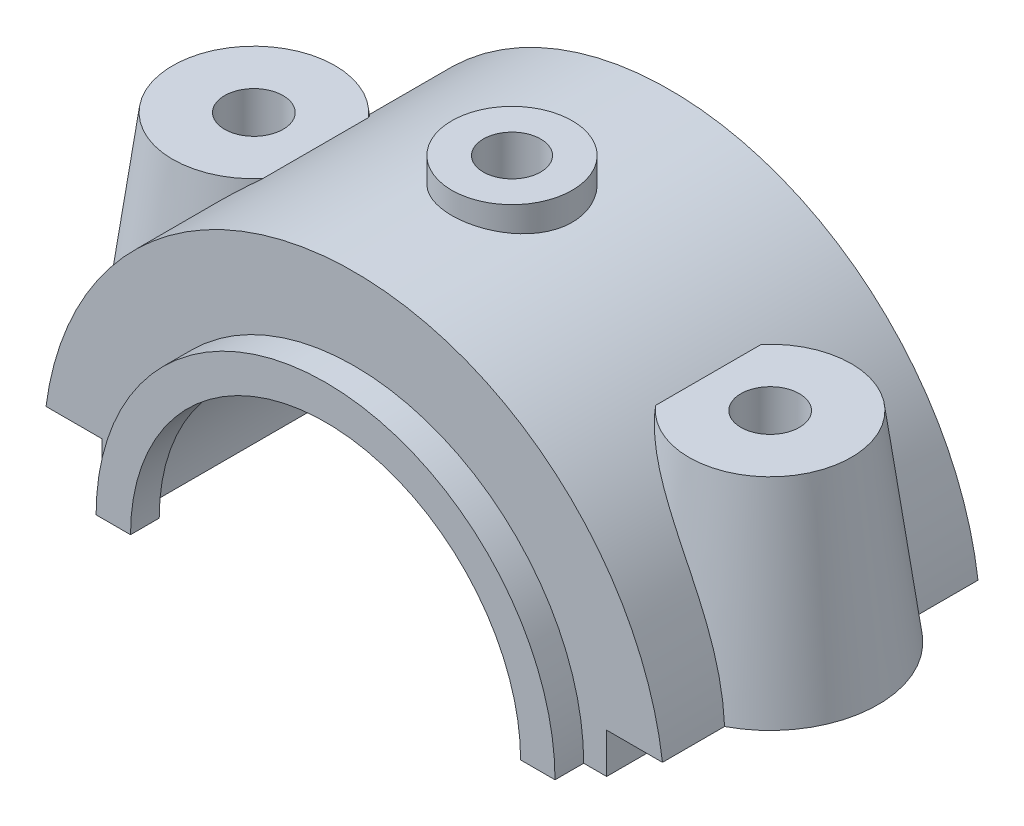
SolidWorks part; units mm, degrees
ref_plane "前视基准面" through (0, 0, 0) normal (0, 0, 1) x (1, 0, 0)
ref_plane "上视基准面" through (0, 0, 0) normal (0, 1, 0) x (1, 0, 0)
ref_plane "右视基准面" through (0, 0, 0) normal (1, 0, 0) x (0, 0, -1)
sketch "草图1" plane through (0, 0, 0) normal (0, 0, 1) x (1, 0, 0)
  line L0 (0, 0) -> (0, 153.2464) construction
  line L1 (-53.7333, 77) -> (-44, 77)
  line L2 (-44, 77) -> (-44, 70)
  line L3 (-44, 70) -> (-40, 70)
  line L4 (-55.1879, 66.0906) -> (-49.1983, 111.0131) construction
  line L5 (-54, 75) -> (-60, 30) construction
  line L6 (-44, 75) -> (-54, 75) construction
  line L7 (0, 124.1874) -> (0, 110)
  arc A0 (-40, 70) -> (0, 110) centre (0, 70) cw
  arc A1 (-53.7333, 77) -> (0, 124.1874) centre (0, 70) cw
  dimension "D1" = 2
extrude "拉伸1" add sketch "草图1" along normal mid plane 55
sketch "草图2" plane through (0, 0, 0) normal (0, 0, 1) x (1, 0, 0)
  line L0 (-40, 70) -> (-34, 70)
  line L1 (0, 110) -> (0, 104)
  arc A0 (0, 110) -> (-40, 70) centre (0, 70) ccw construction
  arc A1 (0, 110) -> (-40, 70) centre (0, 70) ccw
  arc A2 (-34, 70) -> (0, 104) centre (0, 70) cw
extrude "拉伸2" add sketch "草图2" along normal up to surface (32.5 mm away) and the other way up to surface (32.5 mm away)
sketch "草图4" plane through (0, 0, 0) normal (0, 0, 1) x (1, 0, 0)
  line L0 (-45, 4) -> (-45, 133.4851) construction
  line L1 (-60, 4) -> (-30, 4) construction
  line L2 (-45, 77) -> (-63.8218, 77)
  line L3 (-63.8218, 77) -> (-59.1552, 112)
  line L4 (-59.1552, 112) -> (-45, 112)
  line L5 (-45, 112) -> (-45, 77)
  line L6 (-53.7333, 77) -> (-44, 77) construction
  line L7 (-64.0885, 75) -> (-69.5552, 34) construction
  line L8 (-120, 0) -> (-60, 0) construction
  dimension "D1" = 112
revolve "旋转2" add sketch "草图4" angle 360 about L0
hole_wizard "M12 螺纹孔1" positions "草图6" profile "草图5" tap size "M12" standard "ISO"
sketch "草图6" plane through (0, 112, 0) normal (0, 1, 0) x (-1, 0, 0)
  point P1 (45, 0)
sketch "草图5" plane through (-45, 112, 0) normal (1, 0, 0) x (0, 0, 1)
  line L0 (0, 0) -> (0, 42)
  line L1 (0, 42) -> (5.1, 42)
  line L2 (5.1, 42) -> (5.1, 0)
  line L5 (5.1, 0) -> (0, 0)
  line L11 (0, -6.35) -> (0, 107.95) construction
  dimension "籵謂蹟恇謂郰芛眻噤" = 10.2
  dimension "籵謂蹟恇謂郰芛旮僅" = 42
sketch "草图7" plane through (0, 0, 0) normal (0, 0, 1) x (1, 0, 0)
  line L0 (0, 70) -> (-37, 70)
  line L1 (0, 107) -> (0, 70)
  arc A0 (0, 107) -> (-37, 70) centre (0, 70) ccw
  dimension "D1" = 37
extrude "切除-拉伸2" cut sketch "草图7" against normal up to surface and the other way up to surface
mirror "镜向1" about plane through (0, 124.1874, 27.5) normal (-1, 0, 0)
ref_plane "基准面1" through (0, 128, 0) normal (0, 1, 0) x (-1, 0, 0)
sketch "草图8" plane through (0, 128, 0) normal (0, 1, 0) x (-1, 0, 0)
  circle A0 centre (0, 0) radius 10.5
  dimension "D1" = 21
extrude "拉伸3" add sketch "草图8" against normal up to next
sketch "草图9" plane through (0, 0, 0) normal (0, 0, 1) x (1, 0, 0)
  line L0 (0, 110) -> (0, 115.2362) construction
  line L1 (-3, 106) -> (0, 106)
  line L2 (-3, 99.8496) -> (-3, 96) construction
  line L3 (0, 114) -> (-3, 114)
  line L4 (-3, 114) -> (-3, 106)
  line L5 (0, 106) -> (0, 114)
  line L7 (3, 96) -> (-3, 96) construction
  arc A0 (40, 70) -> (-40, 70) centre (0, 70) ccw construction
  dimension "D1" = 10
  dimension "D2" = 18
revolve "切除-旋转2" cut sketch "草图9" angle 360 about L0
sketch "草图10" plane through (0, 128, 0) normal (0, 1, 0) x (1, 0, 0)
  circle A0 centre (0, 0) radius 5
  dimension "D1" = 10
extrude "切除-拉伸3" cut sketch "草图10" against normal blind 14
